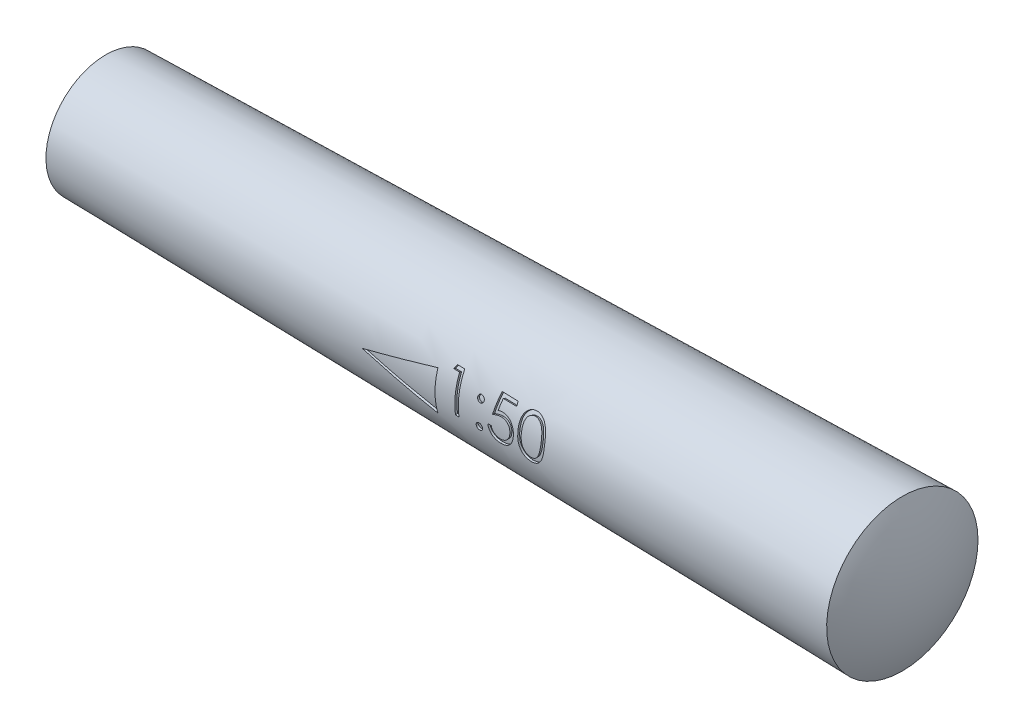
SolidWorks part; units mm, degrees
ref_plane "Front Plane" through (0, 0, 0) normal (0, 0, 1) x (1, 0, 0)
ref_plane "Top Plane" through (0, 0, 0) normal (0, 1, 0) x (1, 0, 0)
ref_plane "Right Plane" through (0, 0, 0) normal (1, 0, 0) x (0, 0, -1)
sketch "Sketch1" plane through (0, 0, 0) normal (1, 0, 0) x (0, 0, -1)
  circle A0 centre (0, 0) radius 1.5
  dimension "D1" = 3
extrude "Extrude1" add sketch "Sketch1" along normal mid plane 20
draft "Draft1" type of draft neutral plane draft angle 1.146 faces to draft 1 parameters "D1"=1.146
sketch "Sketch2" plane through (0, 0, 0) normal (0, 0, 1) x (1, 0, 0)
  line L0 (-10, 0) -> (-10, 1.5)
  line L1 (-10, 1.5) -> (-10, -1.5) construction
  line L2 (-10, 0) -> (-10.45, 0)
  line L3 (-10.45, 0) -> (-10.45, -1.7) construction
  line L4 (10, 0) -> (10, 1.9)
  line L5 (10, -1.9) -> (10, 1.9) construction
  line L6 (10, 0) -> (10.45, 0)
  line L7 (10.45, 0) -> (10.45, -1.7) construction
  line L8 (-10, -1.5) -> (10, -1.9) construction
  arc A0 (-10.45, 0) -> (-10, 1.5) centre (-7.725, 0) cw
  arc A1 (10.45, 0) -> (10, 1.9) centre (6.2138, 0) ccw
  point P14 (0, -1.7)
revolve "Revolve1" add sketch "Sketch2" angle 360 about L2
sketch "Sketch5" plane through (0, 0, 0) normal (0, 0, 1) x (1, 0, 0)
  line L0 (0, 1.7) -> (0, -1.7) construction
  line L1 (10, 1.9) -> (-10, 1.5) construction
  line L2 (-10, -1.5) -> (10, -1.9) construction
ref_plane "Plane2" through (0, 0, 0) normal (-0.02, 0, 0.9998) x (0.9998, 0, 0.02)
sketch "Sketch6" plane through (0, 0, 0) normal (-0.02, 0, 0.9998) x (0.9998, 0, 0.02)
  line L0 (0, 0) -> (0, 0.5)
  line L1 (0, 1.7) -> (0, -1.7) construction
  line L2 (0, 0.5) -> (-1.866, 0)
  line L3 (-1.866, 0) -> (0, -0.5)
  line L4 (0, -0.5) -> (0, 0)
  line L5 (0, -0.25) -> (3, -0.25) construction
  text T0 "1:50" font "Century Gothic" height 1
  dimension "D1" = 1
  dimension "D2" = 30
  dimension "D3" = 3
wrap "Wrap2" sketch "Sketch6" wrap type deboss source sketch "Sketch6" thickness 0.05 parameters "D1"=0.05
equation "\"D2@Sketch2\" = \"D1@Sketch2\""
